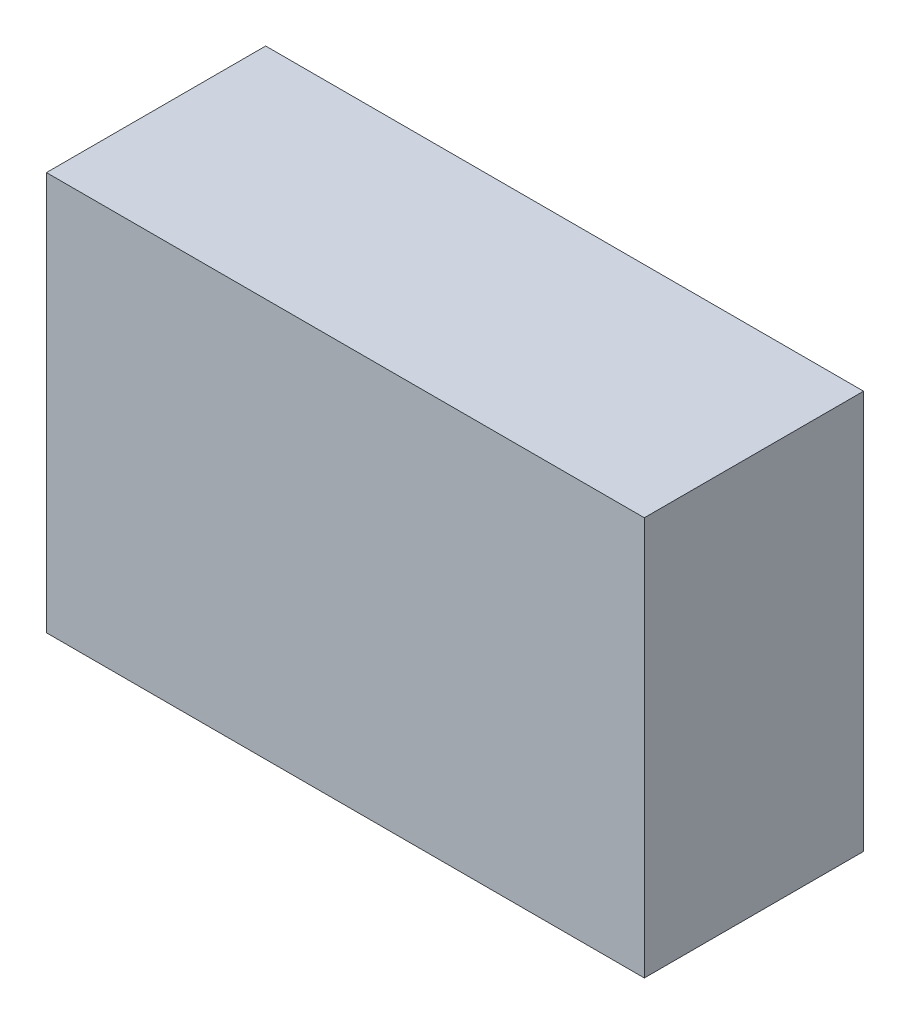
SolidWorks part; units mm, degrees
ref_plane "Přední rovina" through (0, 0, 0) normal (0, 0, 1) x (1, 0, 0)
ref_plane "Horní rovina" through (0, 0, 0) normal (0, 1, 0) x (1, 0, 0)
ref_plane "Pravá rovina" through (0, 0, 0) normal (1, 0, 0) x (0, 0, -1)
sketch "Skica1" plane through (0, 0, 0) normal (0, 0, 1) x (1, 0, 0)
  line L1 (0, 0) -> (150, 0)
  line L2 (0, 0) -> (0, 100)
  line L3 (0, 100) -> (150, 100)
  line L4 (150, 0) -> (150, 100)
  point P5 (150, 100)
extrude "Přidat vysunutím1" add sketch "Skica1" along normal blind 55
